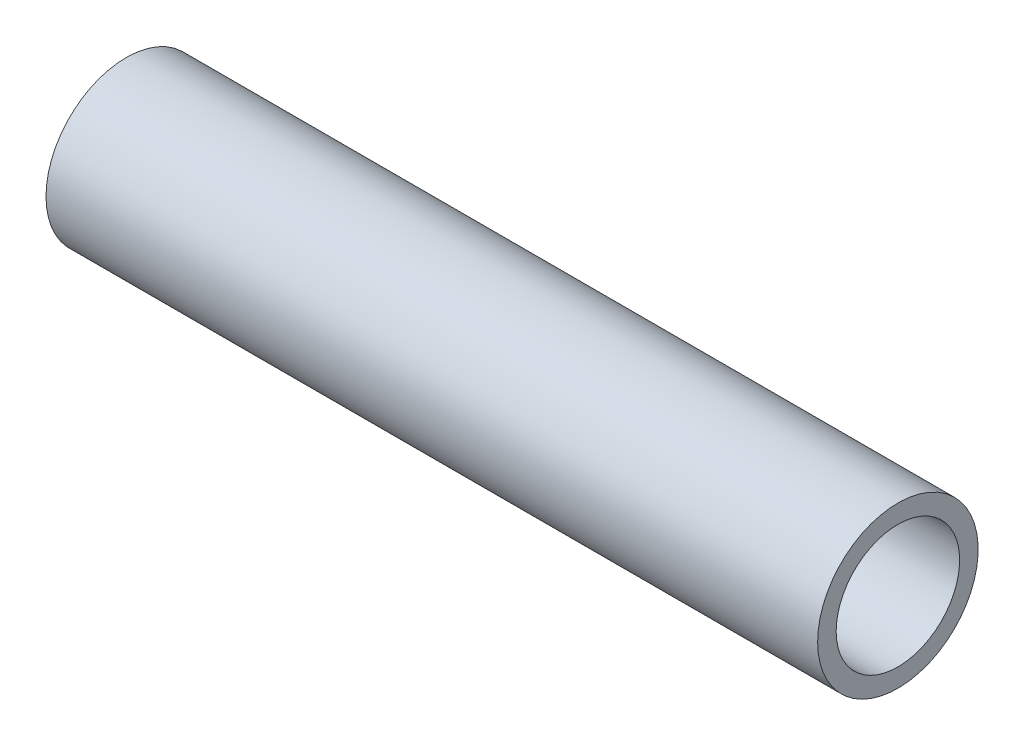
SolidWorks part; units mm, degrees
ref_plane "Front" through (0, 0, 0) normal (0, 0, 1) x (1, 0, 0)
ref_plane "Top" through (0, 0, 0) normal (0, 1, 0) x (1, 0, 0)
ref_plane "Right" through (0, 0, 0) normal (1, 0, 0) x (0, 0, -1)
sketch "Sketch1" plane through (0, 0, 0) normal (0, 0, 1) x (1, 0, 0)
  line L0 (0, 0) -> (158.75, 0)
  line L1 (9.9848, 0) -> (-9.9848, 0) construction
  dimension "D1" = 158.75
other "Structural Member1"
ref_plane "Plane1" through (0, 0, 0) normal (1, 0, 0) x (0, 0, -1)
sketch "Sketch11" plane through (0, 0, 0) normal (1, 0, 0) x (0, 0, -1)
  circle A0 centre (0, 0) radius 12.7
  circle A1 centre (0, 0) radius 16.51
  point P3 (0, 0)
  dimension "D1" = 33.02
  dimension "D2" = 25.4
